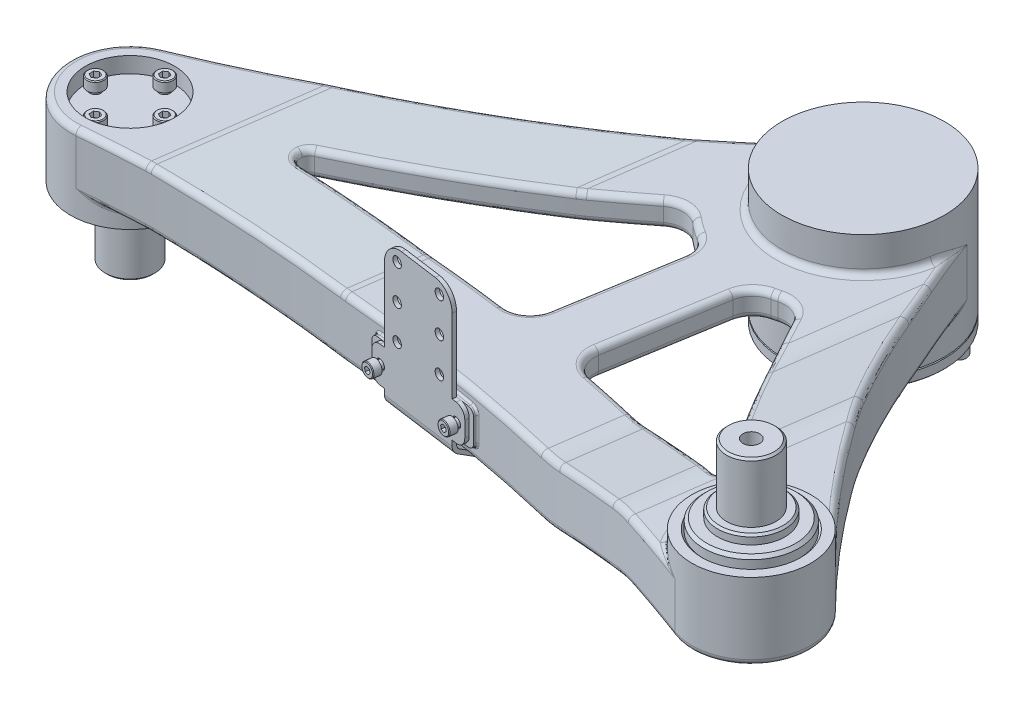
SolidWorks part; units mm, degrees
ref_plane "前视基准面" through (0, 0, 0) normal (0, 0, 1) x (1, 0, 0)
ref_plane "上视基准面" through (0, 0, 0) normal (0, 1, 0) x (1, 0, 0)
ref_plane "右视基准面" through (0, 0, 0) normal (1, 0, 0) x (0, 0, -1)
imported_body "输入1"
imported_body "输入2"
imported_body "输入4"
imported_body "输入5"
imported_body "输入6"
imported_body "输入7"
imported_body "输入9"
imported_body "输入10"
imported_body "输入11"
imported_body "输入12"
imported_body "输入14"
imported_body "输入15"
imported_body "输入16"
imported_body "输入17"
imported_body "输入18"
imported_body "输入20"
imported_body "输入21"
imported_body "输入23"
imported_body "输入24"
imported_body "输入25"
imported_body "输入26"
imported_body "输入27"
imported_body "输入28"
imported_body "输入29"
imported_body "输入30"
imported_body "输入31"
imported_body "输入32"
imported_body "输入33"
imported_body "输入34"
imported_body "输入35"
imported_body "输入36"
imported_body "输入37"
imported_body "输入38"
imported_body "输入39"
imported_body "输入40"
imported_body "输入41"
imported_body "输入42"
imported_body "输入44"
imported_body "输入45"
imported_body "输入47"
imported_body "输入48"
imported_body "输入49"
imported_body "输入50"
imported_body "输入51"
imported_body "输入52"
imported_body "输入53"
imported_body "输入54"
imported_body "输入55"
imported_body "输入56"
imported_body "输入57"
sketch "草图1" plane through (0, 0, 0) normal (1, 0, 0) x (0, 0, -1)
  line L0 (-1239.673, -162) -> (-1316.6931, -162) construction
  line L1 (-1364.7978, -162) -> (-1229.3503, -162)
  line L2 (-1530.5829, -162) -> (-1530.5829, -281.3814)
  line L3 (-1530.5829, -281.3814) -> (-1229.3503, -281.3814)
  line L4 (-1229.3503, -162) -> (-1229.3503, -281.3814)
  line L5 (-1530.5829, -162) -> (-1530.5829, -72.1976)
  line L6 (-1530.5829, -72.1976) -> (-1420.3511, -85.3205)
  line L7 (-1420.3511, -85.3205) -> (-1364.7978, -162)
extrude "切除-拉伸1" cut sketch "草图1" against normal through all both and the other way through all flip side to cut
